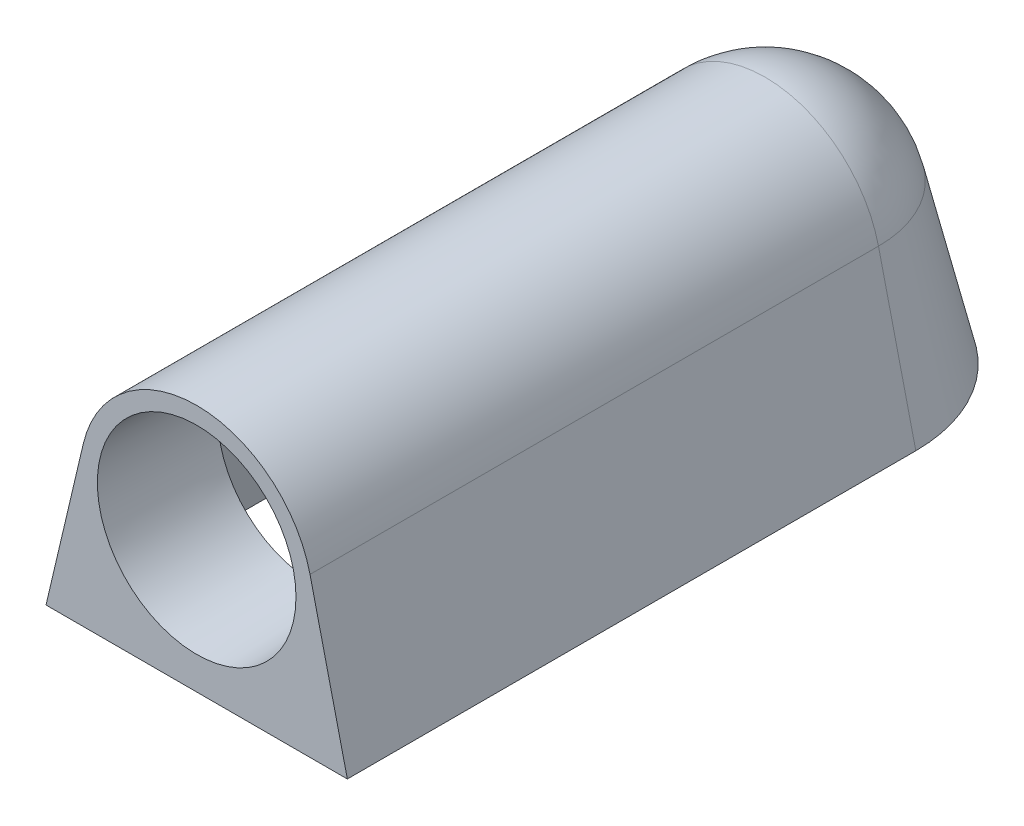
SolidWorks part; units mm, degrees
ref_plane "Front" through (0, 0, 0) normal (0, 0, 1) x (1, 0, 0)
ref_plane "Top" through (0, 0, 0) normal (0, 1, 0) x (1, 0, 0)
ref_plane "Right" through (0, 0, 0) normal (1, 0, 0) x (0, 0, -1)
sketch "Sketch1" plane through (0, 0, 0) normal (0, 0, 1) x (1, 0, 0)
  line L0 (0, 0) -> (0, 18.415)
  line L1 (8.4059, 11.7592) -> (11.176, 0)
  line L2 (11.176, 0) -> (0, 0)
  arc A0 (0, 18.415) -> (8.4059, 11.7592) centre (0, 9.779) cw
  dimension "D1" = 8.636
  dimension "D2" = 11.176
  dimension "D3" = 18.415
revolve "Revolve1" add sketch "Sketch1" angle 180 about L0
sketch "Sketch2" plane through (0, 0, 0) normal (0, 0, 1) x (1, 0, 0)
  line L3 (-11.176, 0) -> (11.176, 0)
  line L4 (11.176, 0) -> (8.4059, 11.7592)
  line L5 (-8.4059, 11.7592) -> (-11.176, 0)
  line L6 (-11.176, 0) -> (11.176, 0)
  line L7 (11.176, 0) -> (8.4059, 11.7592)
  line L8 (-8.4059, 11.7592) -> (-11.176, 0)
  arc A1 (8.4059, 11.7592) -> (-8.4059, 11.7592) centre (0, 9.779) ccw
  arc A2 (8.4059, 11.7592) -> (-8.4059, 11.7592) centre (0, 9.779) ccw
  dimension "D1" = 0
extrude "Extrude1" add sketch "Sketch2" along normal blind 42.164
sketch "Sketch3" plane through (0, 0, 42.164) normal (0, 0, 1) x (1, 0, 0)
  circle A0 centre (0, 9.779) radius 7.366
  dimension "D1" = 14.732
extrude "Cut-Extrude1" cut sketch "Sketch3" against normal blind 8.636 draft 2
shell "Shell1" thickness 1.27
